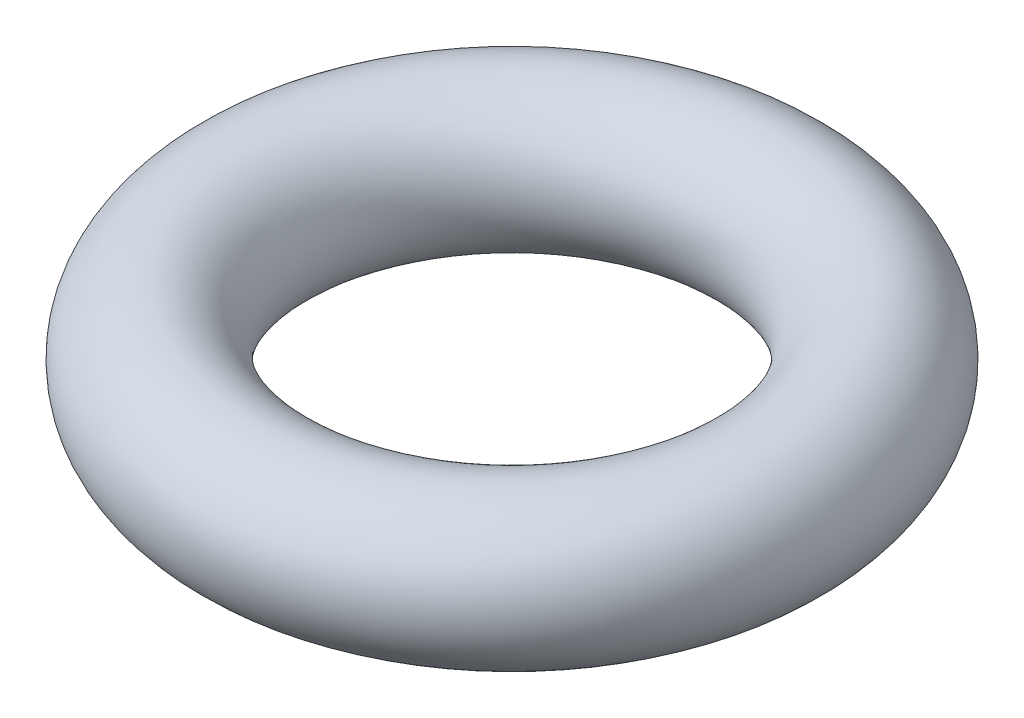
SolidWorks part; units mm, degrees
ref_plane "Front" through (0, 0, 0) normal (0, 0, 1) x (1, 0, 0)
ref_plane "Top" through (0, 0, 0) normal (0, 1, 0) x (1, 0, 0)
ref_plane "Right" through (0, 0, 0) normal (1, 0, 0) x (0, 0, -1)
sketch "Sketch1" plane through (0, 0, 0) normal (0, 1, 0) x (1, 0, 0)
  circle A0 centre (0, 0) radius 3.1242
sketch "Sketch2" plane through (0, 0, 0) normal (0, 0, 1) x (1, 0, 0)
  line L0 (3.1242, 0) -> (-3.1242, 0) construction
  circle A0 centre (-3.1242, 0) radius 0.889
  dimension "D1" = 3.1242
sweep "Sweep1" add profiles "Sketch2" path "Sketch1"
